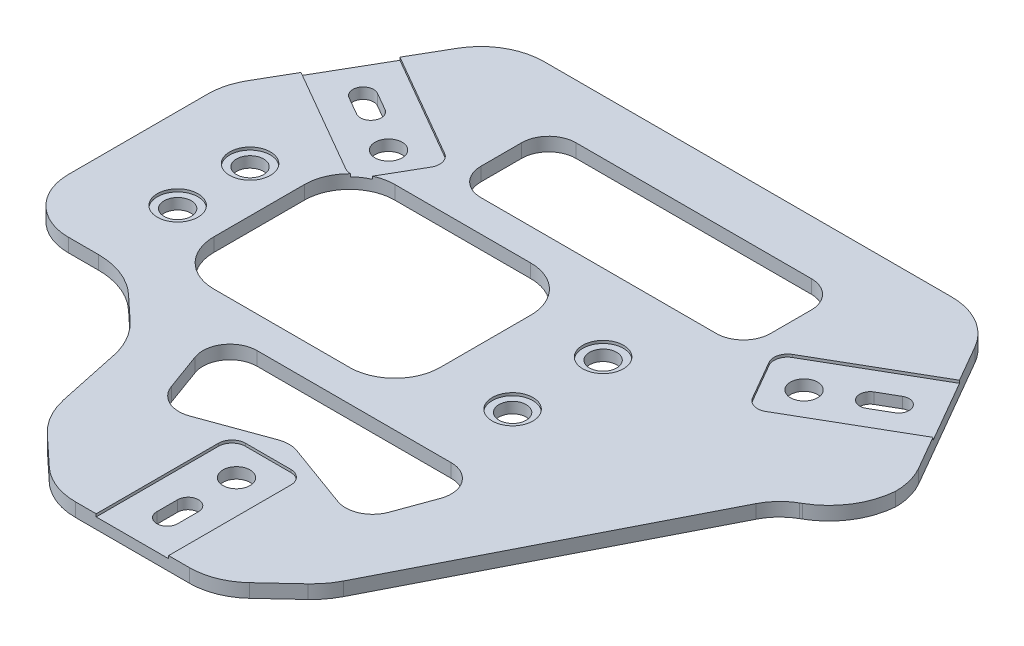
SolidWorks part; units mm, degrees
ref_plane "Front Plane" through (0, 0, 0) normal (0, 0, 1) x (1, 0, 0)
ref_plane "Top Plane" through (0, 0, 0) normal (0, 1, 0) x (1, 0, 0)
ref_plane "Right Plane" through (0, 0, 0) normal (1, 0, 0) x (0, 0, -1)
imported_body "PEN-019375-2020 vFinal.step"
sketch "Sketch1" plane through (0, 1.5, 0) normal (0, 1, 0) x (1, 0, 0)
  line L1 (-242.3525, -216.2983) -> (-238.9945, -216.2983)
  line L2 (-242.3525, -216.2983) -> (-242.3525, -220.3638)
  line L3 (-242.3525, -220.3638) -> (-238.9945, -220.3638)
  line L4 (-238.9945, -216.2983) -> (-238.9945, -220.3638)
  line L5 (-242.3525, -229.0649) -> (-238.9945, -229.0649)
  line L6 (-242.3525, -229.0649) -> (-242.3525, -233.0857)
  line L7 (-242.3525, -233.0857) -> (-238.9945, -233.0857)
  line L8 (-238.9945, -229.0649) -> (-238.9945, -233.0857)
  line L9 (-187.1625, -216.4158) -> (-182.8486, -216.4158)
  line L10 (-187.1625, -216.4158) -> (-187.1625, -220.0414)
  line L11 (-187.1625, -220.0414) -> (-182.8486, -220.0414)
  line L12 (-182.8486, -216.4158) -> (-182.8486, -220.0414)
  line L13 (-187.1625, -230.35) -> (-182.9896, -230.35)
  line L14 (-187.1625, -230.35) -> (-187.1625, -233.959)
  line L15 (-187.1625, -233.959) -> (-182.9896, -233.959)
  line L16 (-182.9896, -230.35) -> (-182.9896, -233.959)
extrude "Boss-Extrude1" add sketch "Sketch1" against normal up to surface (1.5 mm away)
sketch "Sketch2" plane through (0, 1.5, 0) normal (0, 1, 0) x (1, 0, 0)
  line L0 (-210.6744, -262.7812) -> (-210.6744, -249.2812) construction
  line L1 (-209.1744, -247.7812) -> (-204.1744, -247.7812) construction
  line L2 (-202.6744, -249.2812) -> (-202.6744, -262.7812) construction
  line L3 (-202.6744, -262.7812) -> (-210.6744, -262.7812) construction
  line L4 (-175.7655, -202.3171) -> (-171.7655, -209.2453) construction
  line L5 (-171.7655, -209.2453) -> (-183.4568, -215.9953) construction
  line L6 (-185.5059, -215.4463) -> (-188.0059, -211.1162) construction
  line L7 (-187.4568, -209.0671) -> (-175.7655, -202.3171) construction
  line L8 (-225.343, -211.1162) -> (-227.7088, -215.2138) construction
  line L9 (-229.8921, -215.9953) -> (-241.5834, -209.2453) construction
  line L10 (-241.5834, -209.2453) -> (-237.5834, -202.3171) construction
  line L11 (-237.5834, -202.3171) -> (-225.8921, -209.0671) construction
  line L12 (-210.6744, -262.7812) -> (-210.6744, -249.2812)
  line L13 (-209.1744, -247.7812) -> (-204.1744, -247.7812)
  line L14 (-202.6744, -249.2812) -> (-202.6744, -262.7812)
  line L15 (-202.6744, -262.7812) -> (-210.6744, -262.7812)
  line L16 (-175.7655, -202.3171) -> (-171.7655, -209.2453)
  line L17 (-171.7655, -209.2453) -> (-183.4568, -215.9953)
  line L18 (-185.5059, -215.4463) -> (-188.0059, -211.1162)
  line L19 (-187.4568, -209.0671) -> (-175.7655, -202.3171)
  line L20 (-225.343, -211.1162) -> (-227.7088, -215.2138)
  line L21 (-229.8921, -215.9953) -> (-241.5834, -209.2453)
  line L22 (-241.5834, -209.2453) -> (-237.5834, -202.3171)
  line L23 (-237.5834, -202.3171) -> (-225.8921, -209.0671)
  arc A0 (-235.6744, -226.5312) -> (-235.6744, -231.0312) centre (-235.6744, -228.7812) ccw construction
  arc A1 (-235.6744, -231.0312) -> (-235.6744, -226.5312) centre (-235.6744, -228.7812) ccw construction
  arc A2 (-235.6744, -218.5312) -> (-235.6744, -223.0312) centre (-235.6744, -220.7812) ccw construction
  arc A3 (-235.6744, -223.0312) -> (-235.6744, -218.5312) centre (-235.6744, -220.7812) ccw construction
  arc A4 (-197.6744, -232.0312) -> (-197.6744, -227.5312) centre (-197.6744, -229.7812) ccw construction
  arc A5 (-197.6744, -227.5312) -> (-197.6744, -232.0312) centre (-197.6744, -229.7812) ccw construction
  arc A6 (-197.6744, -217.5312) -> (-197.6744, -222.0312) centre (-197.6744, -219.7812) ccw construction
  arc A7 (-197.6744, -222.0312) -> (-197.6744, -217.5312) centre (-197.6744, -219.7812) ccw construction
  arc A8 (-209.1744, -247.7812) -> (-210.6744, -249.2812) centre (-209.1744, -249.2812) ccw construction
  arc A9 (-202.6744, -249.2812) -> (-204.1744, -247.7812) centre (-204.1744, -249.2812) ccw construction
  arc A10 (-185.5059, -215.4463) -> (-183.4568, -215.9953) centre (-184.2068, -214.6963) ccw construction
  arc A11 (-187.4568, -209.0671) -> (-188.0059, -211.1162) centre (-186.7068, -210.3662) ccw construction
  arc A12 (-227.7088, -215.2138) -> (-229.1598, -216.1962) centre (-225.6744, -219.7812) ccw construction
  arc A13 (-229.8921, -215.9953) -> (-229.1598, -216.1962) centre (-229.1421, -214.6963) ccw construction
  arc A14 (-225.343, -211.1162) -> (-225.8921, -209.0671) centre (-226.6421, -210.3662) ccw construction
  arc A15 (-235.6744, -226.5312) -> (-235.6744, -231.0312) centre (-235.6744, -228.7812) ccw
  arc A16 (-235.6744, -231.0312) -> (-235.6744, -226.5312) centre (-235.6744, -228.7812) ccw
  arc A17 (-235.6744, -218.5312) -> (-235.6744, -223.0312) centre (-235.6744, -220.7812) ccw
  arc A18 (-235.6744, -223.0312) -> (-235.6744, -218.5312) centre (-235.6744, -220.7812) ccw
  arc A19 (-197.6744, -232.0312) -> (-197.6744, -227.5312) centre (-197.6744, -229.7812) ccw
  arc A20 (-197.6744, -227.5312) -> (-197.6744, -232.0312) centre (-197.6744, -229.7812) ccw
  arc A21 (-197.6744, -217.5312) -> (-197.6744, -222.0312) centre (-197.6744, -219.7812) ccw
  arc A22 (-197.6744, -222.0312) -> (-197.6744, -217.5312) centre (-197.6744, -219.7812) ccw
  arc A23 (-209.1744, -247.7812) -> (-210.6744, -249.2812) centre (-209.1744, -249.2812) ccw
  arc A24 (-202.6744, -249.2812) -> (-204.1744, -247.7812) centre (-204.1744, -249.2812) ccw
  arc A25 (-185.5059, -215.4463) -> (-183.4568, -215.9953) centre (-184.2068, -214.6963) ccw
  arc A26 (-187.4568, -209.0671) -> (-188.0059, -211.1162) centre (-186.7068, -210.3662) ccw
  arc A27 (-227.7088, -215.2138) -> (-229.1598, -216.1962) centre (-225.6744, -219.7812) ccw
  arc A28 (-229.8921, -215.9953) -> (-229.1598, -216.1962) centre (-229.1421, -214.6963) ccw
  arc A29 (-225.343, -211.1162) -> (-225.8921, -209.0671) centre (-226.6421, -210.3662) ccw
extrude "Cut-Extrude1" cut sketch "Sketch2" against normal blind 0.3
sketch "Sketch3" plane through (0, 0, 0) normal (0, -1, 0) x (1, 0, 0)
  line L0 (-175.7655, 202.3171) -> (-171.7655, 209.2453) construction
  line L1 (-171.7655, 209.2453) -> (-183.4568, 215.9953) construction
  line L2 (-185.5059, 215.4463) -> (-188.0059, 211.1162) construction
  line L3 (-187.4568, 209.0671) -> (-175.7655, 202.3171) construction
  line L4 (-225.343, 211.1162) -> (-227.7088, 215.2138) construction
  line L5 (-229.8921, 215.9953) -> (-241.5834, 209.2453) construction
  line L6 (-241.5834, 209.2453) -> (-237.5834, 202.3171) construction
  line L7 (-237.5834, 202.3171) -> (-225.8921, 209.0671) construction
  line L8 (-210.6744, 262.7812) -> (-210.6744, 249.2812) construction
  line L9 (-209.1744, 247.7812) -> (-204.1744, 247.7812) construction
  line L10 (-202.6744, 249.2812) -> (-202.6744, 262.7812) construction
  line L11 (-202.6744, 262.7812) -> (-210.6744, 262.7812) construction
  line L12 (-175.7655, 202.3171) -> (-171.7655, 209.2453)
  line L13 (-171.7655, 209.2453) -> (-183.4568, 215.9953)
  line L14 (-185.5059, 215.4463) -> (-188.0059, 211.1162)
  line L15 (-187.4568, 209.0671) -> (-175.7655, 202.3171)
  line L16 (-225.343, 211.1162) -> (-227.7088, 215.2138)
  line L17 (-229.8921, 215.9953) -> (-241.5834, 209.2453)
  line L18 (-241.5834, 209.2453) -> (-237.5834, 202.3171)
  line L19 (-237.5834, 202.3171) -> (-225.8921, 209.0671)
  line L20 (-210.6744, 262.7812) -> (-210.6744, 249.2812)
  line L21 (-209.1744, 247.7812) -> (-204.1744, 247.7812)
  line L22 (-202.6744, 249.2812) -> (-202.6744, 262.7812)
  line L23 (-202.6744, 262.7812) -> (-210.6744, 262.7812)
  arc A0 (-183.4568, 215.9953) -> (-185.5059, 215.4463) centre (-184.2068, 214.6963) ccw construction
  arc A1 (-188.0059, 211.1162) -> (-187.4568, 209.0671) centre (-186.7068, 210.3662) ccw construction
  arc A2 (-229.1598, 216.1962) -> (-227.7088, 215.2138) centre (-225.6744, 219.7812) ccw construction
  arc A3 (-229.1598, 216.1962) -> (-229.8921, 215.9953) centre (-229.1421, 214.6963) ccw construction
  arc A4 (-225.8921, 209.0671) -> (-225.343, 211.1162) centre (-226.6421, 210.3662) ccw construction
  arc A5 (-235.6744, 223.0312) -> (-235.6744, 218.5312) centre (-235.6744, 220.7812) ccw construction
  arc A6 (-235.6744, 218.5312) -> (-235.6744, 223.0312) centre (-235.6744, 220.7812) ccw construction
  arc A7 (-197.6744, 222.0312) -> (-197.6744, 217.5312) centre (-197.6744, 219.7812) ccw construction
  arc A8 (-197.6744, 217.5312) -> (-197.6744, 222.0312) centre (-197.6744, 219.7812) ccw construction
  arc A9 (-197.6744, 227.5312) -> (-197.6744, 232.0312) centre (-197.6744, 229.7812) ccw construction
  arc A10 (-197.6744, 232.0312) -> (-197.6744, 227.5312) centre (-197.6744, 229.7812) ccw construction
  arc A11 (-235.6744, 231.0312) -> (-235.6744, 226.5312) centre (-235.6744, 228.7812) ccw construction
  arc A12 (-235.6744, 226.5312) -> (-235.6744, 231.0312) centre (-235.6744, 228.7812) ccw construction
  arc A13 (-210.6744, 249.2812) -> (-209.1744, 247.7812) centre (-209.1744, 249.2812) ccw construction
  arc A14 (-204.1744, 247.7812) -> (-202.6744, 249.2812) centre (-204.1744, 249.2812) ccw construction
  arc A15 (-183.4568, 215.9953) -> (-185.5059, 215.4463) centre (-184.2068, 214.6963) ccw
  arc A16 (-188.0059, 211.1162) -> (-187.4568, 209.0671) centre (-186.7068, 210.3662) ccw
  arc A17 (-229.1598, 216.1962) -> (-227.7088, 215.2138) centre (-225.6744, 219.7812) ccw
  arc A18 (-229.1598, 216.1962) -> (-229.8921, 215.9953) centre (-229.1421, 214.6963) ccw
  arc A19 (-225.8921, 209.0671) -> (-225.343, 211.1162) centre (-226.6421, 210.3662) ccw
  arc A20 (-235.6744, 223.0312) -> (-235.6744, 218.5312) centre (-235.6744, 220.7812) ccw
  arc A21 (-235.6744, 218.5312) -> (-235.6744, 223.0312) centre (-235.6744, 220.7812) ccw
  arc A22 (-197.6744, 222.0312) -> (-197.6744, 217.5312) centre (-197.6744, 219.7812) ccw
  arc A23 (-197.6744, 217.5312) -> (-197.6744, 222.0312) centre (-197.6744, 219.7812) ccw
  arc A24 (-197.6744, 227.5312) -> (-197.6744, 232.0312) centre (-197.6744, 229.7812) ccw
  arc A25 (-197.6744, 232.0312) -> (-197.6744, 227.5312) centre (-197.6744, 229.7812) ccw
  arc A26 (-235.6744, 231.0312) -> (-235.6744, 226.5312) centre (-235.6744, 228.7812) ccw
  arc A27 (-235.6744, 226.5312) -> (-235.6744, 231.0312) centre (-235.6744, 228.7812) ccw
  arc A28 (-210.6744, 249.2812) -> (-209.1744, 247.7812) centre (-209.1744, 249.2812) ccw
  arc A29 (-204.1744, 247.7812) -> (-202.6744, 249.2812) centre (-204.1744, 249.2812) ccw
extrude "Boss-Extrude2" add sketch "Sketch3" against normal up to surface (0.3 mm away)
sketch "Sketch4" plane through (0, 0.3, 0) normal (0, 1, 0) x (1, 0, 0)
  line L0 (-205.5244, -258.9312) -> (-205.5244, -256.6312) construction
  line L1 (-207.8244, -256.6312) -> (-207.8244, -258.9312) construction
  line L2 (-178.5165, -209.8522) -> (-176.5247, -208.7022) construction
  line L3 (-177.6747, -206.7103) -> (-179.6665, -207.8603) construction
  line L4 (-233.6824, -207.8603) -> (-235.6742, -206.7103) construction
  line L5 (-236.8242, -208.7022) -> (-234.8324, -209.8522) construction
  line L6 (-205.5244, -258.9312) -> (-205.5244, -256.6312)
  line L7 (-207.8244, -256.6312) -> (-207.8244, -258.9312)
  line L8 (-178.5165, -209.8522) -> (-176.5247, -208.7022)
  line L9 (-177.6747, -206.7103) -> (-179.6665, -207.8603)
  line L10 (-233.6824, -207.8603) -> (-235.6742, -206.7103)
  line L11 (-236.8242, -208.7022) -> (-234.8324, -209.8522)
  arc A0 (-205.5244, -256.6312) -> (-207.8244, -256.6312) centre (-206.6744, -256.6312) ccw construction
  arc A1 (-207.8244, -258.9312) -> (-206.6744, -260.0812) centre (-206.6744, -258.9312) ccw construction
  arc A2 (-206.6744, -260.0812) -> (-205.5244, -258.9312) centre (-206.6744, -258.9312) ccw construction
  arc A3 (-206.6744, -249.7812) -> (-206.6744, -252.7812) centre (-206.6744, -251.2812) ccw construction
  arc A4 (-206.6744, -252.7812) -> (-206.6744, -249.7812) centre (-206.6744, -251.2812) ccw construction
  arc A5 (-176.5247, -208.7022) -> (-177.6747, -206.7103) centre (-177.0997, -207.7062) ccw construction
  arc A6 (-179.6665, -207.8603) -> (-179.0915, -210.0062) centre (-179.0915, -208.8562) ccw construction
  arc A7 (-179.0915, -210.0062) -> (-178.5165, -209.8522) centre (-179.0915, -208.8562) ccw construction
  arc A8 (-183.7248, -210.0312) -> (-183.7248, -213.0312) centre (-183.7248, -211.5312) ccw construction
  arc A9 (-183.7248, -213.0312) -> (-183.7248, -210.0312) centre (-183.7248, -211.5312) ccw construction
  arc A10 (-197.6744, -228.2812) -> (-197.6744, -231.2812) centre (-197.6744, -229.7812) ccw construction
  arc A11 (-197.6744, -231.2812) -> (-197.6744, -228.2812) centre (-197.6744, -229.7812) ccw construction
  arc A12 (-197.6744, -218.2812) -> (-197.6744, -221.2812) centre (-197.6744, -219.7812) ccw construction
  arc A13 (-197.6744, -221.2812) -> (-197.6744, -218.2812) centre (-197.6744, -219.7812) ccw construction
  arc A14 (-235.6744, -227.2812) -> (-235.6744, -230.2812) centre (-235.6744, -228.7812) ccw construction
  arc A15 (-235.6744, -230.2812) -> (-235.6744, -227.2812) centre (-235.6744, -228.7812) ccw construction
  arc A16 (-235.6744, -219.2812) -> (-235.6744, -222.2812) centre (-235.6744, -220.7812) ccw construction
  arc A17 (-235.6744, -222.2812) -> (-235.6744, -219.2812) centre (-235.6744, -220.7812) ccw construction
  arc A18 (-229.6241, -210.0312) -> (-229.6241, -213.0312) centre (-229.6241, -211.5312) ccw construction
  arc A19 (-229.6241, -213.0312) -> (-229.6241, -210.0312) centre (-229.6241, -211.5312) ccw construction
  arc A20 (-235.6742, -206.7103) -> (-236.8242, -208.7022) centre (-236.2492, -207.7062) ccw construction
  arc A21 (-234.8324, -209.8522) -> (-234.2574, -210.0062) centre (-234.2574, -208.8562) ccw construction
  arc A22 (-234.2574, -210.0062) -> (-233.6824, -207.8603) centre (-234.2574, -208.8562) ccw construction
  arc A23 (-205.5244, -256.6312) -> (-207.8244, -256.6312) centre (-206.6744, -256.6312) ccw
  arc A24 (-207.8244, -258.9312) -> (-206.6744, -260.0812) centre (-206.6744, -258.9312) ccw
  arc A25 (-206.6744, -260.0812) -> (-205.5244, -258.9312) centre (-206.6744, -258.9312) ccw
  arc A26 (-206.6744, -249.7812) -> (-206.6744, -252.7812) centre (-206.6744, -251.2812) ccw
  arc A27 (-206.6744, -252.7812) -> (-206.6744, -249.7812) centre (-206.6744, -251.2812) ccw
  arc A28 (-176.5247, -208.7022) -> (-177.6747, -206.7103) centre (-177.0997, -207.7062) ccw
  arc A29 (-179.6665, -207.8603) -> (-179.0915, -210.0062) centre (-179.0915, -208.8562) ccw
  arc A30 (-179.0915, -210.0062) -> (-178.5165, -209.8522) centre (-179.0915, -208.8562) ccw
  arc A31 (-183.7248, -210.0312) -> (-183.7248, -213.0312) centre (-183.7248, -211.5312) ccw
  arc A32 (-183.7248, -213.0312) -> (-183.7248, -210.0312) centre (-183.7248, -211.5312) ccw
  arc A33 (-197.6744, -228.2812) -> (-197.6744, -231.2812) centre (-197.6744, -229.7812) ccw
  arc A34 (-197.6744, -231.2812) -> (-197.6744, -228.2812) centre (-197.6744, -229.7812) ccw
  arc A35 (-197.6744, -218.2812) -> (-197.6744, -221.2812) centre (-197.6744, -219.7812) ccw
  arc A36 (-197.6744, -221.2812) -> (-197.6744, -218.2812) centre (-197.6744, -219.7812) ccw
  arc A37 (-235.6744, -227.2812) -> (-235.6744, -230.2812) centre (-235.6744, -228.7812) ccw
  arc A38 (-235.6744, -230.2812) -> (-235.6744, -227.2812) centre (-235.6744, -228.7812) ccw
  arc A39 (-235.6744, -219.2812) -> (-235.6744, -222.2812) centre (-235.6744, -220.7812) ccw
  arc A40 (-235.6744, -222.2812) -> (-235.6744, -219.2812) centre (-235.6744, -220.7812) ccw
  arc A41 (-229.6241, -210.0312) -> (-229.6241, -213.0312) centre (-229.6241, -211.5312) ccw
  arc A42 (-229.6241, -213.0312) -> (-229.6241, -210.0312) centre (-229.6241, -211.5312) ccw
  arc A43 (-235.6742, -206.7103) -> (-236.8242, -208.7022) centre (-236.2492, -207.7062) ccw
  arc A44 (-234.8324, -209.8522) -> (-234.2574, -210.0062) centre (-234.2574, -208.8562) ccw
  arc A45 (-234.2574, -210.0062) -> (-233.6824, -207.8603) centre (-234.2574, -208.8562) ccw
extrude "Cut-Extrude2" cut sketch "Sketch4" against normal through all
sketch "Sketch5" plane through (0, 0, 0) normal (0, -1, 0) x (1, 0, 0)
  line L0 (-204.1578, 224.7812) -> (-204.1578, 231.5474) construction
  arc A0 (-206.5171, 232.559) -> (-206.5171, 217.0035) centre (-218.1578, 224.7812) cw
  arc A1 (-205.6744, 229.7812) -> (-210.6744, 234.7812) centre (-210.6744, 229.7812) ccw construction
  arc A2 (-210.6744, 214.7812) -> (-205.6744, 219.7812) centre (-210.6744, 219.7812) ccw construction
  dimension "D1" = 14
ref_plane "Plane3" through (0, 0.75, 0) normal (0, -1, 0) x (-1, 0, 0)
sketch "Sketch7" plane through (0, 0.75, 0) normal (0, -1, 0) x (-1, 0, 0)
  line L0 (206.6744, -224.7812) -> (233.1744, -224.7812)
  line L1 (206.6744, -224.7812) -> (206.6744, -251.2812)
  circle A0 centre (206.6744, -224.7812) radius 26.5
  point P0 (183.7248, -211.5312)
  point P1 (229.6241, -211.5312)
  point P3 (206.6744, -251.2812)
